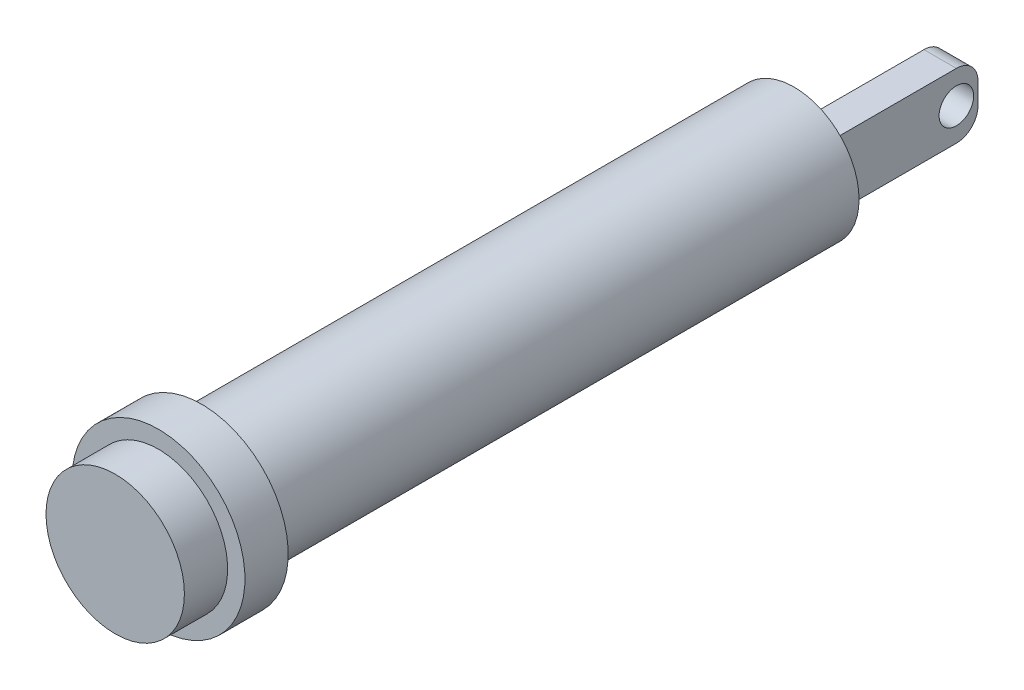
SolidWorks part; units mm, degrees
ref_plane "Front Plane" through (0, 0, 0) normal (0, 0, 1) x (1, 0, 0)
ref_plane "Top Plane" through (0, 0, 0) normal (0, 1, 0) x (1, 0, 0)
ref_plane "Right Plane" through (0, 0, 0) normal (1, 0, 0) x (0, 0, -1)
sketch "Sketch1" plane through (0, 0, 0) normal (1, 0, 0) x (0, 0, -1)
  line L0 (0, 0) -> (500, 0) construction
  line L4 (500, 0) -> (500, 75)
  line L6 (500, 75) -> (0, 75)
  line L7 (0, 75) -> (0, 0)
  line L10 (0, 0) -> (500, 0)
  dimension "D1" = 500
  dimension "D2" = 75
revolve "Revolve1" add sketch "Sketch1" angle 360 about L0
sketch "Sketch10" plane through (0, 0, -500) normal (0, 0, -1) x (-1, 0, 0)
  line L1 (-37.5, -37.5) -> (37.5, -37.5)
  line L2 (-37.5, -37.5) -> (-37.5, 37.5)
  line L3 (-37.5, 37.5) -> (37.5, 37.5)
  line L4 (37.5, -37.5) -> (37.5, 37.5)
  line L5 (-37.5, -37.5) -> (37.5, 37.5) construction
  line L6 (-37.5, 37.5) -> (37.5, -37.5) construction
  point P0 (0, 0)
  dimension "D1" = 75
  dimension "D2" = 75
extrude "Boss-Extrude7" add sketch "Sketch10" along normal blind 175
sketch "Sketch11" plane through (0, 0, -675) normal (0, 0, -1) x (-1, 0, 0)
  line L0 (0, 37.5) -> (0, -37.5)
  line L1 (37.5, 37.5) -> (-37.5, 37.5) construction
  line L2 (-37.5, -37.5) -> (37.5, -37.5) construction
  line L3 (0, -37.5) -> (37.5, -37.5)
  line L4 (37.5, -37.5) -> (37.5, 37.5)
  line L5 (37.5, 37.5) -> (0, 37.5)
extrude "Cut-Extrude1" cut sketch "Sketch11" against normal blind 175
fillet "Fillet1" radius 25 2 edges at (18.75, -37.5, -675) (18.75, 37.5, -675)
sketch "Sketch12" plane through (37.5, 0, 0) normal (1, 0, 0) x (0, 0, -1)
  line L0 (675, 0) -> (650, 0) construction
  line L1 (675, 12.5) -> (675, -12.5) construction
  circle A0 centre (650, 0) radius 20
  dimension "D1" = 25
  dimension "D2" = 40
extrude "Cut-Extrude2" cut sketch "Sketch12" against normal blind 150
sketch "Sketch13" plane through (0, 0, 0) normal (0, 0, 1) x (1, 0, 0)
  circle A0 centre (0, 0) radius 75
extrude "Boss-Extrude8" add sketch "Sketch13" along normal blind 235
sketch "Sketch14" plane through (0, 0, 235) normal (0, 0, 1) x (1, 0, 0)
  circle A0 centre (0, 0) radius 80
  dimension "D1" = 160
extrude "Boss-Extrude9" add sketch "Sketch14" along normal blind 50
sketch "Sketch15" plane through (0, 0, 235) normal (0, 0, -1) x (-1, 0, 0)
  circle A0 centre (0, 0) radius 100
extrude "Boss-Extrude10" add sketch "Sketch15" along normal blind 50
